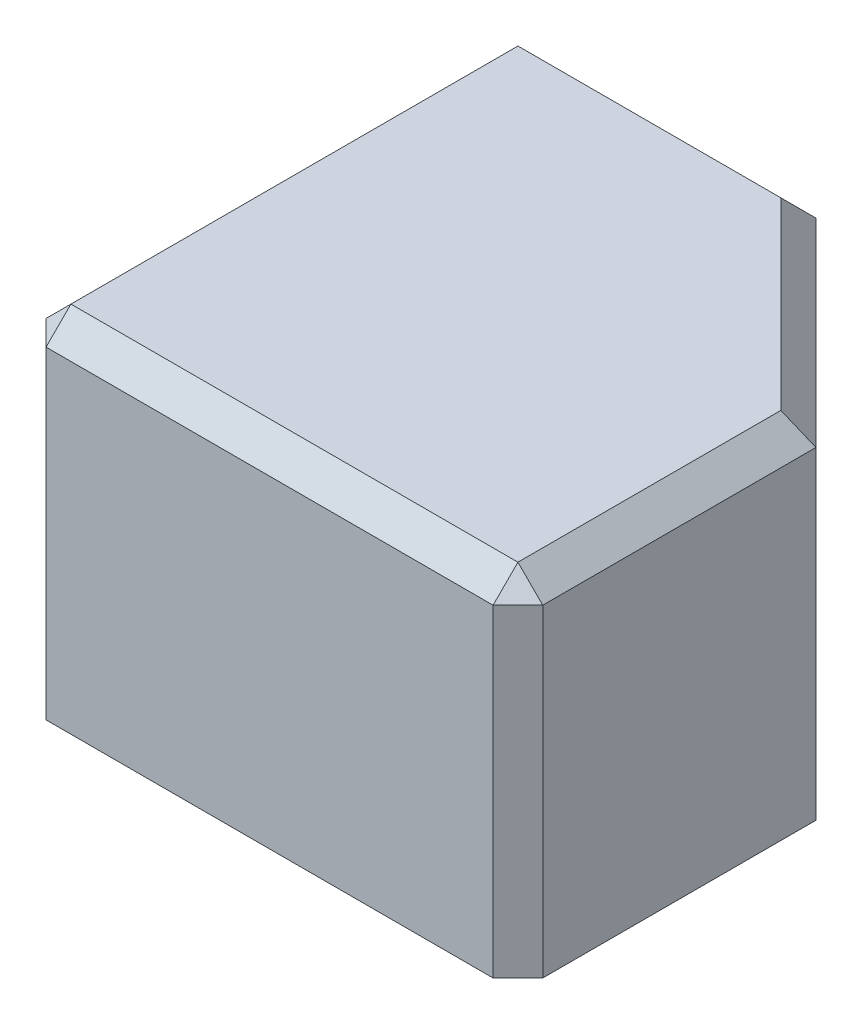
SolidWorks part; units mm, degrees
ref_plane "Front Plane" through (0, 0, 0) normal (0, 0, 1) x (1, 0, 0)
ref_plane "Top Plane" through (0, 0, 0) normal (0, 1, 0) x (1, 0, 0)
ref_plane "Right Plane" through (0, 0, 0) normal (1, 0, 0) x (0, 0, -1)
sketch "Sketch1" plane through (0, 0, 0) normal (0, 1, 0) x (1, 0, 0)
  line L0 (0, 0) -> (0, 10)
  line L1 (0, 10) -> (6, 10)
  line L2 (6, 10) -> (10, 6)
  line L3 (10, 6) -> (10, 0)
  line L4 (10, 0) -> (0, 0)
  dimension "D1" = 10
  dimension "D2" = 10
  dimension "D3" = 6
  dimension "D4" = 6
  dimension "D5" = 5.6569
  dimension "D6" = 135
extrude "Boss-Extrude1" add sketch "Sketch1" along normal blind 7
hole_wizard "Ø1.65 (1.65) Diameter Hole2" positions "Sketch5" profile "Sketch4" hole size "Ø1.65" standard "ISO"
sketch "Sketch5" plane through (0, 0, -10) normal (0, 0, -1) x (-1, 0, 0)
  line L0 (0, 7) -> (0, 0) construction
  line L1 (-6, 0) -> (0, 0) construction
  point P0 (-3, 5)
  dimension "D1" = 3
  dimension "D2" = 5
sketch "Sketch4" plane through (3, 5, -10) normal (1, 0, 0) x (0, 1, 0)
  line L0 (0, 0) -> (0, 7.825)
  line L1 (0, 7.825) -> (0.825, 7)
  line L2 (0.825, 7) -> (0.825, 0)
  line L5 (0.825, 0) -> (0, 0)
  line L10 (0, 7.825) -> (-0.825, 7) construction
  line L11 (0, -6.35) -> (0, 107.95) construction
  dimension "Hole Dia." = 1.65
  dimension "Hole Depth" = 7
  dimension "Drill Angle" = 90
hole_wizard "Ø1.65 (1.65) Diameter Hole3" positions "Sketch7" profile "Sketch6" hole size "Ø1.65" standard "ISO"
sketch "Sketch7" plane through (8, 0, -8) normal (0.7071, 0, -0.7071) x (-0.7071, 0, -0.7071)
  line L0 (-2.8284, 0) -> (2.8284, 0) construction
  point P0 (0, 5)
  dimension "D1" = 5
sketch "Sketch6" plane through (8, 5, -8) normal (0, 1, 0) x (-0.7071, 0, -0.7071)
  line L0 (0, 0) -> (0, 6.5)
  line L1 (0, 6.5) -> (0.825, 6.5)
  line L2 (0.825, 6.5) -> (0.825, 0)
  line L5 (0.825, 0) -> (0, 0)
  line L10 (0, 6.5) -> (-0.825, 6.5) construction
  line L11 (0, -6.35) -> (0, 107.95) construction
  dimension "Hole Dia." = 1.65
  dimension "Hole Depth" = 6.5
  dimension "Drill Angle" = 180
hole_wizard "M1.6 Tapped Hole1" positions "Sketch9" profile "Sketch8" tap size "M1.6" standard "ISO"
sketch "Sketch9" plane through (0, 0, 0) normal (0, -1, 0) x (-1, 0, 0)
  line L0 (-6, 10) -> (0, 10) construction
  line L1 (0, 10) -> (0, 0) construction
  line L2 (-10, 0) -> (-10, 6) construction
  line L3 (0, 0) -> (-10, 0) construction
  point P0 (-5.1, 8)
  point P2 (-8, 5.1)
  point P5 (-3, 10)
  point P15 (-2, 2)
  dimension "D1" = 2
  dimension "D2" = 5.1
  dimension "D3" = 2
  dimension "D4" = 5.1
  dimension "D5" = 2
  dimension "D6" = 2
sketch "Sketch8" plane through (5.1, 0, -8) normal (1, 0, 0) x (0, 0, -1)
  line L0 (0, 0) -> (0, 3.8755)
  line L1 (0, 3.8755) -> (0.625, 3.5)
  line L2 (0.625, 3.5) -> (0.625, 0)
  line L5 (0.625, 0) -> (0, 0)
  line L10 (0, 3.8755) -> (-0.625, 3.5) construction
  line L11 (0, -6.35) -> (0, 107.95) construction
  dimension "Tap Drill Dia." = 1.25
  dimension "Tap Drill Depth" = 3.5
  dimension "Drill Angle" = 118
chamfer "Chamfer1" distance 0.5 angle 45 8 edges at (10, 7, -3) (8, 7, -8) (3, 7, -10) (5, 7, 0) (0, 7, -5) (0, 3.5, 0) (10, 3.5, 0) (0, 3.5, -10)
